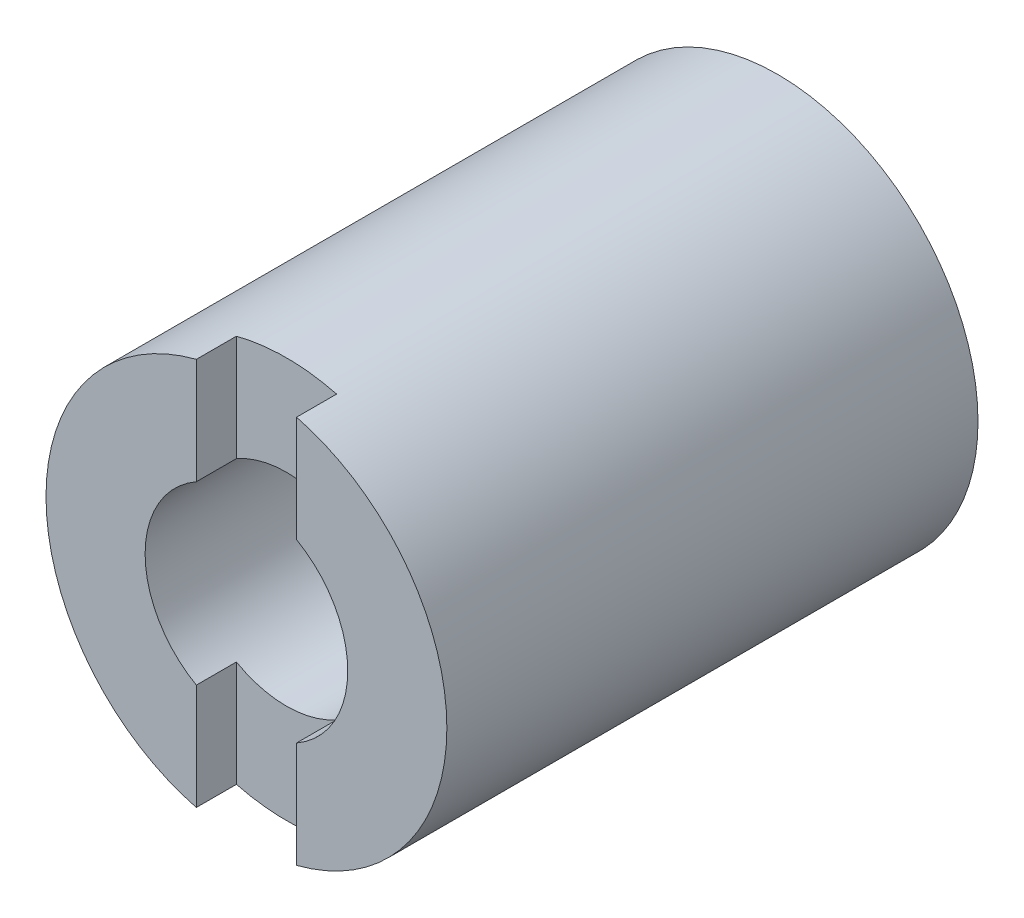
SolidWorks part; units mm, degrees
ref_plane "face" through (0, 0, 0) normal (0, 0, 1) x (1, 0, 0)
ref_plane "dessus" through (0, 0, 0) normal (0, 1, 0) x (1, 0, 0)
ref_plane "profil" through (0, 0, 0) normal (1, 0, 0) x (0, 0, -1)
sketch "Esquisse1" plane through (0, 0, 0) normal (0, 0, 1) x (1, 0, 0)
  circle A0 centre (0, 0) radius 10
  circle A1 centre (0, 0) radius 5.055
  dimension "D1" = 10.11
  dimension "D2" = 20
extrude "Base-Extrusion" add sketch "Esquisse1" along normal blind 26.5
extrude "Enlèv. mat.-Extru.1" cut sketch "Esquisse2" against normal blind 2
sketch "Esquisse2" plane through (0, 0, 26.5) normal (0, 0, 1) x (1, 0, 0)
  line L1 (-2.5, 11) -> (2.5, 11)
  line L2 (-2.5, 11) -> (-2.5, -11)
  line L3 (-2.5, -11) -> (2.5, -11)
  line L4 (2.5, 11) -> (2.5, -11)
  dimension "D1" = 2.5
  dimension "D2" = 5
sketch "Esq_WRNL_Compact001" plane through (0, 0, 0) normal (0, 0, 1) x (1, 0, 0)
  line L0 (-11, -11) -> (-11, 11)
  line L1 (11, -11) -> (11, 11)
  line L2 (-11, -11) -> (11, -11)
  line L3 (-11, 11) -> (11, 11)
